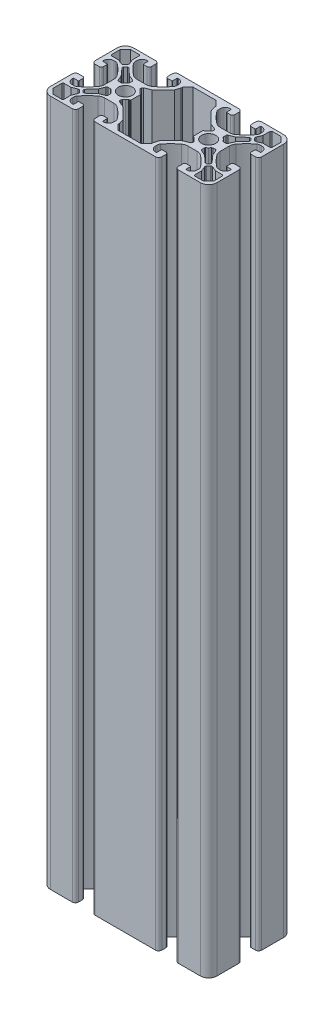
SolidWorks part; units mm, degrees
other "2018_08_28__13-15-45-812"
ref_plane "Ebene vorne" through (0, 0, 0) normal (0, 0, 1) x (1, 0, 0)
ref_plane "Ebene oben" through (0, 0, 0) normal (0, 1, 0) x (1, 0, 0)
ref_plane "Ebene rechts" through (0, 0, 0) normal (1, 0, 0) x (0, 0, -1)
imported_body "Importiert1"
sketch "Skizze1" plane through (0, 1500, 0) normal (0, 1, 0) x (1, 0, 0)
  line L1 (-42.1729, 21.5096) -> (46.3623, 21.5096)
  line L2 (-42.1729, 21.5096) -> (-42.1729, -27.1691)
  line L3 (-42.1729, -27.1691) -> (46.3623, -27.1691)
  line L4 (46.3623, 21.5096) -> (46.3623, -27.1691)
extrude "Schnitt-Linear austragen1" cut sketch "Skizze1" against normal offset from surface (2670 mm away) 330
